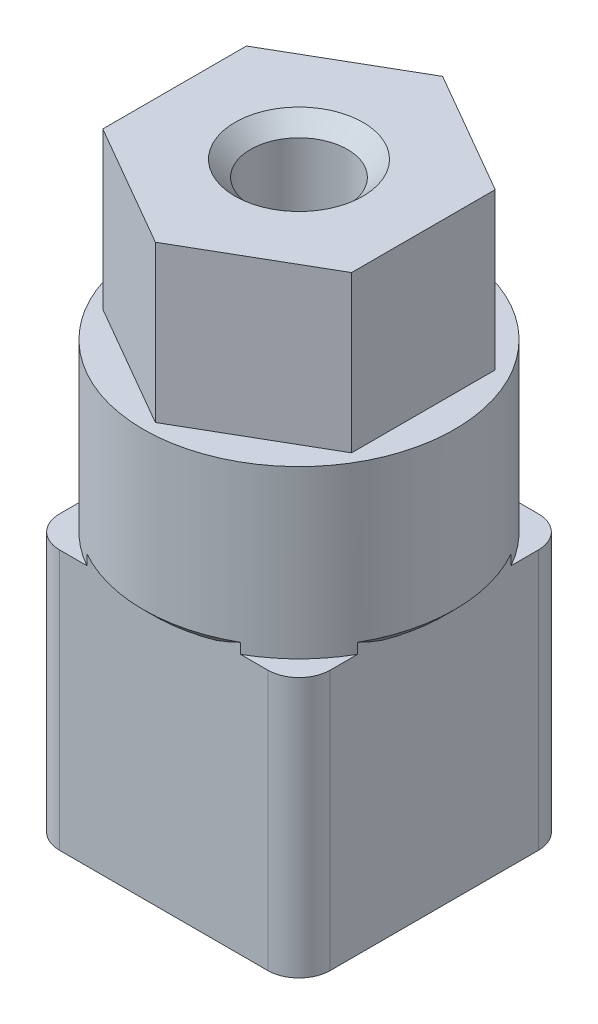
SolidWorks part; units mm, degrees
ref_plane "Front Plane" through (0, 0, 0) normal (0, 0, 1) x (1, 0, 0)
ref_plane "Top Plane" through (0, 0, 0) normal (0, 1, 0) x (1, 0, 0)
ref_plane "Right Plane" through (0, 0, 0) normal (1, 0, 0) x (0, 0, -1)
sketch "Sketch1" plane through (0, 0, 0) normal (0, 1, 0) x (1, 0, 0)
  line L1 (10, -13) -> (-10, -13)
  line L2 (13, -10) -> (13, 10)
  line L3 (10, 13) -> (-10, 13)
  line L4 (-13, -10) -> (-13, 10)
  line L5 (13, -13) -> (-13, 13) construction
  line L6 (13, 13) -> (-13, -13) construction
  arc A0 (10, -13) -> (13, -10) centre (10, -10) ccw
  arc A1 (-10, -13) -> (-13, -10) centre (-10, -10) cw
  arc A2 (13, 10) -> (10, 13) centre (10, 10) ccw
  arc A3 (-10, 13) -> (-13, 10) centre (-10, 10) ccw
  point P0 (0, 0)
  dimension "D3" = 3
  dimension "D1" = 26
  dimension "D2" = 26
extrude "Boss-Extrude1" add sketch "Sketch1" along normal blind 25
sketch "Sketch2" plane through (0, 25, 0) normal (0, 1, 0) x (1, 0, 0)
  circle A0 centre (0, 0) radius 14.95
  dimension "D1" = 29.9
extrude "Boss-Extrude2" add sketch "Sketch2" along normal blind 16
sketch "Sketch3" plane through (0, 41, 0) normal (0, 1, 0) x (1, 0, 0)
  line L1 (0, 13.7987) -> (-11.95, 6.8993)
  line L2 (-11.95, 6.8993) -> (-11.95, -6.8993)
  line L3 (-11.95, -6.8993) -> (0, -13.7987)
  line L4 (0, -13.7987) -> (11.95, -6.8993)
  line L5 (11.95, -6.8993) -> (11.95, 6.8993)
  line L6 (11.95, 6.8993) -> (0, 13.7987)
  circle A0 centre (0, 0) radius 11.95 construction
  dimension "D1" = 23.9
extrude "Boss-Extrude3" add sketch "Sketch3" along normal blind 15
sketch "Sketch5" plane through (0, 56, 0) normal (0, 1, 0) x (1, 0, 0)
  circle A0 centre (0, 0) radius 4.65
  dimension "D1" = 9.3
extrude "Cut-Extrude1" cut sketch "Sketch5" against normal through all
chamfer "Chamfer2" distance 1.5 angle 45 1 edges at (0, 56, 4.65)
chamfer "Chamfer3" distance 23 angle 13 1 edges at (0, 0, 4.65)
chamfer "Chamfer4" distance 1 angle 45 4 edges at (14.95, 25, 0) (0, 25, -14.95) (-14.95, 25, 0) (0, 25, 14.95)
